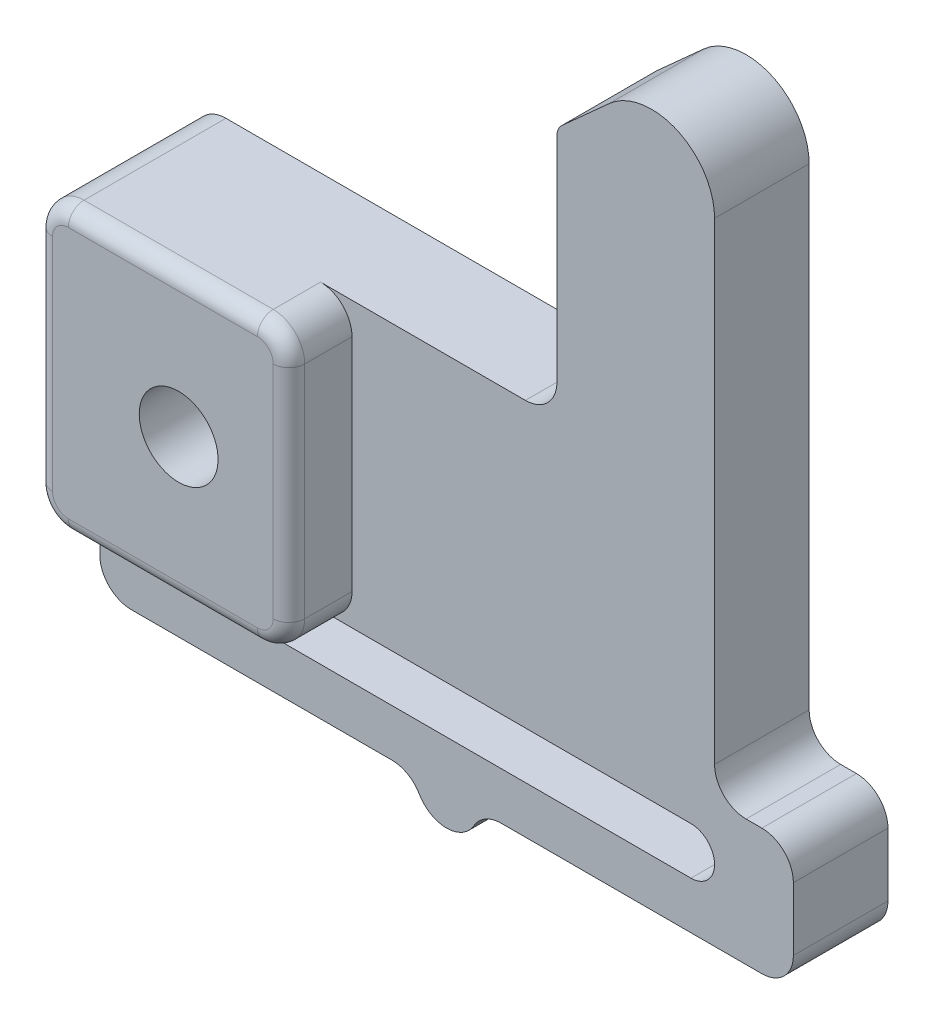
SolidWorks part; units mm, degrees
ref_plane "Face" through (0, 0, 0) normal (0, 0, 1) x (1, 0, 0)
ref_plane "Dessus" through (0, 0, 0) normal (0, 1, 0) x (1, 0, 0)
ref_plane "Droite" through (0, 0, 0) normal (1, 0, 0) x (0, 0, -1)
sketch "Esquisse1" plane through (0, 0, 0) normal (0, 0, 1) x (1, 0, 0)
  line L0 (1, 0) -> (9.2679, 0)
  line L1 (19.5, 5) -> (19.5, 20)
  line L2 (14.5, 19.7674) -> (14.5, 13)
  line L3 (19.5, 0) -> (21, 0)
  line L4 (13.5, 12) -> (1, 12)
  line L5 (0, 11) -> (0, 1)
  line L6 (16.1617, 21.4863) -> (14.6654, 20.139)
  line L7 (22, 1) -> (22, 3)
  line L8 (21, 4) -> (20.5, 4)
  line L9 (11, 3.0826) -> (11, -3.0452) construction
  line L10 (12.7321, 0) -> (19.5, 0)
  arc A0 (19.5, 20) -> (16.1617, 21.4863) centre (17.5, 20) ccw
  arc A1 (14.6654, 20.139) -> (14.5, 19.7674) centre (15, 19.7674) ccw
  arc A2 (10.134, -0.5) -> (11.866, -0.5) centre (11, 0) ccw
  arc A3 (12.7321, 0) -> (11.866, -0.5) centre (12.7321, -1) ccw
  arc A4 (10.134, -0.5) -> (9.2679, 0) centre (9.2679, -1) ccw
  arc A5 (1, 12) -> (0, 11) centre (1, 11) ccw
  arc A6 (1, 0) -> (0, 1) centre (1, 1) cw
  arc A7 (21, 0) -> (22, 1) centre (21, 1) ccw
  arc A8 (22, 3) -> (21, 4) centre (21, 3) ccw
  arc A9 (20.5, 4) -> (19.5, 5) centre (20.5, 5) cw
  arc A10 (14.5, 13) -> (13.5, 12) centre (13.5, 13) cw
  point P25 (0, 12)
  point P28 (0, 0)
  point P31 (22, 0)
  point P34 (22, 4)
  point P37 (19.5, 4)
  dimension "D5" = 4
  dimension "D6" = 1
  dimension "D8" = 5
  dimension "D10" = 2
  dimension "D11" = 2
  dimension "D12" = 2
  dimension "D13" = 1
  dimension "D1" = 12
  dimension "D2" = 20
  dimension "D3" = 19.5
  dimension "D4" = 2.5
  dimension "D7" = 4
  dimension "D9" = 11
  dimension "D14" = 132
extrude "Extrusion1" add sketch "Esquisse1" along normal blind 3
sketch "Esquisse2" plane through (0, 0, 3) normal (0, 0, 1) x (1, 0, 0)
  line L0 (13.5, 12) -> (1, 12) construction
  line L1 (7, 12) -> (1, 12)
  line L2 (8, 11) -> (8, 4)
  line L3 (7, 3) -> (1, 3)
  line L4 (0, 11) -> (0, 4)
  line L5 (0, 11) -> (0, 1) construction
  arc A0 (7, 12) -> (8, 11) centre (7, 11) cw
  arc A1 (1, 12) -> (0, 11) centre (1, 11) ccw
  arc A2 (1, 3) -> (0, 4) centre (1, 4) cw
  arc A3 (8, 4) -> (7, 3) centre (7, 4) cw
  point P10 (8, 12)
  point P13 (0, 12)
  point P18 (8, 3)
  dimension "D3" = 1
  dimension "D1" = 8
  dimension "D2" = 9
extrude "Extrusion2" add sketch "Esquisse2" along normal blind 2
sketch "Esquisse3" plane through (0, 0, 3) normal (0, 0, 1) x (1, 0, 0)
  line L0 (3.25, 2.25) -> (18.75, 2.25) construction
  line L1 (1, 0) -> (9.2679, 0) construction
  line L2 (0, 4) -> (0, 1) construction
  line L3 (22, 1) -> (22, 3) construction
  line L4 (3.25, 3) -> (18.75, 3)
  line L6 (18.75, 1.5) -> (3.25, 1.5)
  arc A0 (3.25, 3) -> (3.25, 1.5) centre (3.25, 2.25) ccw
  arc A1 (18.75, 1.5) -> (18.75, 3) centre (18.75, 2.25) ccw
  point P6 (22, 2)
  dimension "D4" = 1.5
  dimension "D5" = 1.5
  dimension "D1" = 2.25
  dimension "D2" = 3.25
  dimension "D3" = 3.25
extrude "Enlèv. mat.-Extru.1" cut sketch "Esquisse3" against normal through all
sketch "Esquisse4" plane through (0, 0, 0) normal (0, 0, -1) x (-1, 0, 0)
  line L0 (0, 11) -> (0, 1) construction
  line L1 (-7, 10) -> (-2, 10)
  line L2 (-7, 10) -> (-7, 5)
  line L3 (-7, 5) -> (-2, 5)
  line L4 (-2, 10) -> (-2, 5)
  line L5 (-1, 0) -> (-9.2679, 0) construction
  point P6 (-5.134, 0)
  dimension "D1" = 5
  dimension "D2" = 5
  dimension "D3" = 2
  dimension "D4" = 5
extrude "Enlèv. mat.-Extru.2" cut sketch "Esquisse4" against normal blind 3
fillet "Congé1" radius 0.5 8 edges at (8, 7.5, 5) (7.7071, 3.2929, 5) (4, 3, 5) (0.2929, 3.2929, 5) (0, 7.5, 5) (0.2929, 11.7071, 5) (4, 12, 5) (7.7071, 11.7071, 5)
sketch "Esquisse5" plane through (0, 0, 3) normal (0, 0, -1) x (-1, 0, 0)
  line L0 (-2, 10) -> (-7, 10) construction
  line L1 (-2, 5) -> (-2, 10) construction
  circle A0 centre (-4.5, 7.5) radius 1.25
  dimension "D1" = 2.5
  dimension "D2" = 2.5
  dimension "D3" = 2.5
extrude "Enlèv. mat.-Extru.3" cut sketch "Esquisse5" against normal through all
